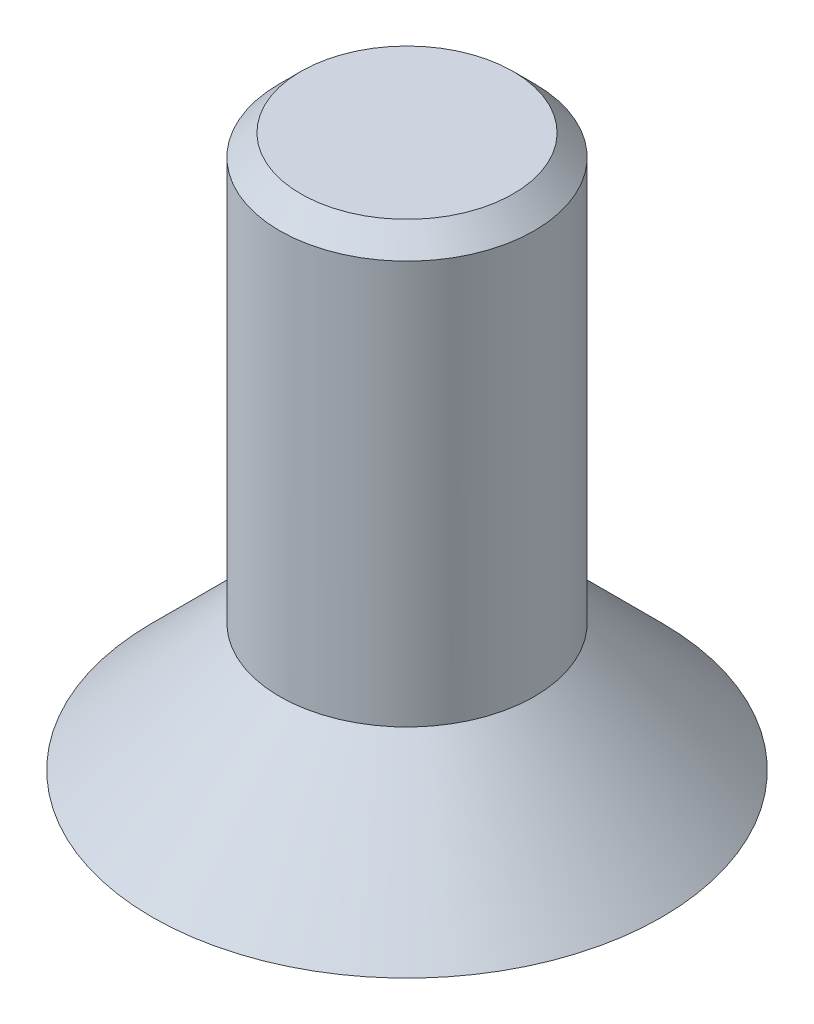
SolidWorks part; units mm, degrees
ref_plane "Face" through (0, 0, 0) normal (0, 0, 1) x (1, 0, 0)
ref_plane "Dessus" through (0, 0, 0) normal (0, 1, 0) x (1, 0, 0)
ref_plane "Droite" through (0, 0, 0) normal (1, 0, 0) x (0, 0, -1)
imported_body "Importée1"
sketch "Esquisse1" plane through (0, -9, 0) normal (0, 1, 0) x (-1, 0, 0)
  circle A0 centre (0, 0) radius 3 construction
  circle A1 centre (0, 0) radius 3
extrude "Extrusion1" add sketch "Esquisse1" against normal blind 2
chamfer "Chanfrein1" distance 0.5 angle 45
